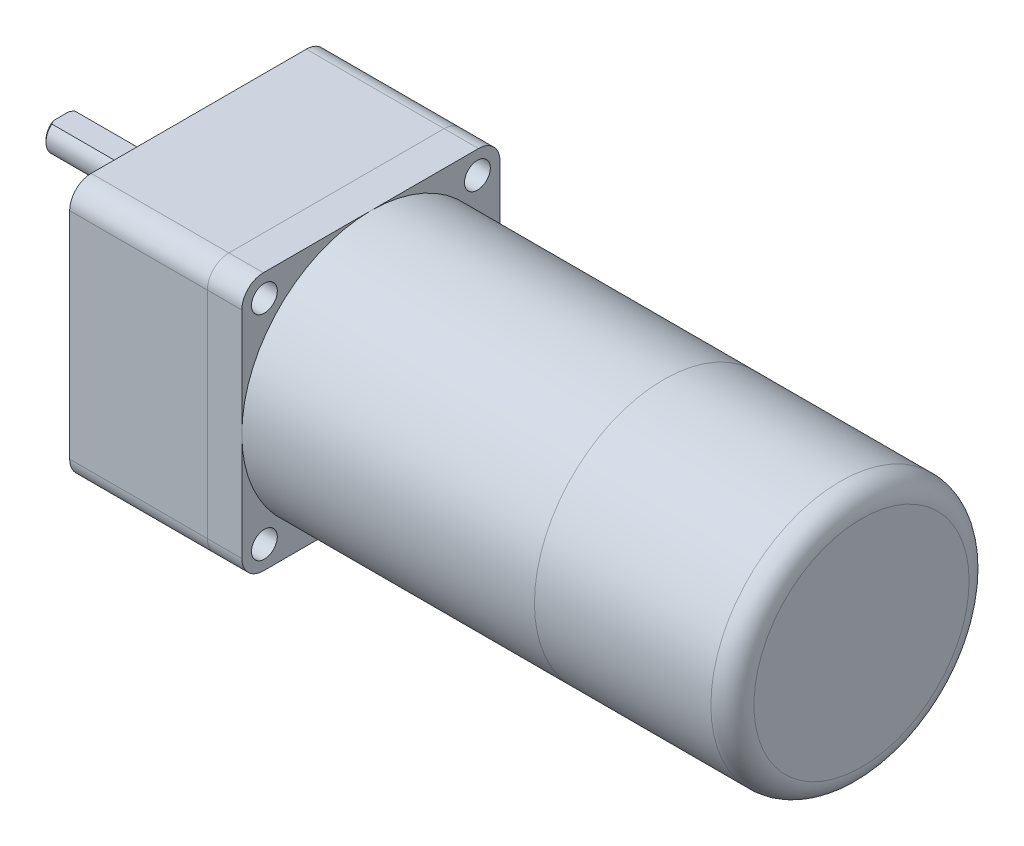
SolidWorks part; units mm, degrees
ref_plane "前视基准面" through (0, 0, 0) normal (0, 0, 1) x (1, 0, 0)
ref_plane "上视基准面" through (0, 0, 0) normal (0, 1, 0) x (1, 0, 0)
ref_plane "右视基准面" through (0, 0, 0) normal (1, 0, 0) x (0, 0, -1)
sketch "草图1" plane through (0, 0, 0) normal (1, 0, 0) x (0, 0, -1)
  line L1 (-25, -30) -> (25, -30)
  line L2 (-30, -25) -> (-30, 25)
  line L3 (-25, 30) -> (25, 30)
  line L4 (30, -25) -> (30, 25)
  line L5 (-30, -30) -> (30, 30) construction
  line L6 (-30, 30) -> (30, -30) construction
  arc A0 (-25, -30) -> (-30, -25) centre (-25, -25) cw
  arc A1 (-30, 25) -> (-25, 30) centre (-25, 25) cw
  arc A2 (25, 30) -> (30, 25) centre (25, 25) cw
  arc A3 (25, -30) -> (30, -25) centre (25, -25) ccw
  point P0 (0, 0)
  dimension "D1" = 5
extrude "凸台-拉伸1" add sketch "草图1" along normal blind 32
sketch "草图2" plane through (32, 0, 0) normal (1, 0, 0) x (0, 0, -1)
  line L0 (25, 30) -> (-25, 30) construction
  line L1 (-25, -30) -> (25, -30)
  line L2 (-30, -25) -> (-30, 25)
  line L3 (-25, 30) -> (25, 30)
  line L4 (30, -25) -> (30, 25)
  line L5 (-30, -30) -> (30, 30) construction
  line L6 (-30, 30) -> (30, -30) construction
  arc A0 (-25, -30) -> (-30, -25) centre (-25, -25) cw
  arc A1 (25, -30) -> (30, -25) centre (25, -25) ccw
  arc A2 (25, 30) -> (30, 25) centre (25, 25) cw
  arc A3 (-30, 25) -> (-25, 30) centre (-25, 25) cw
  point P0 (0, 0)
  dimension "D1" = 5
extrude "凸台-拉伸2" add sketch "草图2" along normal blind 8 separate body
sketch "草图3" plane through (40, 0, 0) normal (1, 0, 0) x (0, 0, -1)
  circle A0 centre (0, 0) radius 30
extrude "凸台-拉伸3" add sketch "草图3" along normal blind 68 separate body
sketch "草图4" plane through (108, 0, 0) normal (1, 0, 0) x (0, 0, -1)
  circle A0 centre (0, 0) radius 30
extrude "凸台-拉伸4" add sketch "草图4" along normal blind 46 separate body
fillet "圆角1" radius 5 1 edges at (154, 0, -30)
sketch "草图5" plane through (0, 0, 0) normal (-1, 0, 0) x (0, 0, 1)
  point P19 (-24.7487, 24.7487)
  point P20 (24.7487, 24.7487)
  point P21 (24.7487, -24.7487)
  point P22 (-24.7487, -24.7487)
hole_wizard "M4 螺纹孔1" positions "3D草图1" profile "草图6" tap size "M4" standard "GB"
sketch3d "3D草图1"
  point P0 (0, 24.7487, -24.7487)
  point P3 (0, 24.7487, 24.7487)
  point P6 (0, -24.7487, 24.7487)
  point P9 (0, -24.7487, -24.7487)
sketch "草图6" plane through (0, 24.7487, -24.7487) normal (0, 1, 0) x (0, 0, 1)
  line L0 (0, 0) -> (0, 12.4914)
  line L1 (0, 12.4914) -> (1.65, 11.5)
  line L2 (1.65, 11.5) -> (1.65, 0)
  line L5 (1.65, 0) -> (0, 0)
  line L10 (0, 12.4914) -> (-1.65, 11.5) construction
  line L11 (0, -6.35) -> (0, 107.95) construction
  dimension "螺纹孔钻头直径" = 3.3
  dimension "螺纹孔钻头深度" = 11.5
  dimension "导头角度" = 118
sketch "草图7" plane through (40, 0, 0) normal (1, 0, 0) x (0, 0, -1)
  circle A1 centre (-24.7487, 24.7487) radius 3
  circle A2 centre (24.7487, 24.7487) radius 3
  circle A3 centre (24.7487, -24.7487) radius 3
  circle A4 centre (-24.7487, -24.7487) radius 3
extrude "切除-拉伸1" cut sketch "草图7" against normal blind 28.5
fillet "圆角2" radius 0.5 4 edges at (0, -24.7487, -23.0987) (0, -24.7487, 26.3987) (0, 24.7487, 26.3987) (0, 24.7487, -23.0987)
sketch "草图8" plane through (0, 0, 0) normal (-1, 0, 0) x (0, 0, 1)
  circle A0 centre (0, 10) radius 12
extrude "凸台-拉伸5" add sketch "草图8" along normal blind 3.3 separate body
fillet "圆角3" radius 0.5 1 edges at (-3.3, 10, 12)
sketch "草图9" plane through (-3.3, 0, 0) normal (-1, 0, 0) x (0, 0, 1)
  circle A0 centre (0, 10) radius 4
extrude "凸台-拉伸6" add sketch "草图9" along normal blind 28.7 separate body
sketch "草图10" plane through (-32, 0, 0) normal (-1, 0, 0) x (0, 0, 1)
  line L2 (2.6458, 13) -> (-2.6458, 13)
  circle A0 centre (0, 10) radius 4 construction
  arc A1 (2.6458, 13) -> (-2.6458, 13) centre (0, 10) ccw
extrude "切除-拉伸2" cut sketch "草图10" against normal blind 25
chamfer "倒角1" distance 0.5 angle 45 1 edges at (-32, 6, 0)
sketch "草图11" plane through (0, 0, 0) normal (-1, 0, 0) x (0, 0, 1)
  circle A0 centre (0, 0) radius 26.3
extrude "切除-拉伸3" cut sketch "草图11" against normal blind 0.5
fillet "圆角4" radius 0.5 1 edges at (0, 0, 26.3)
